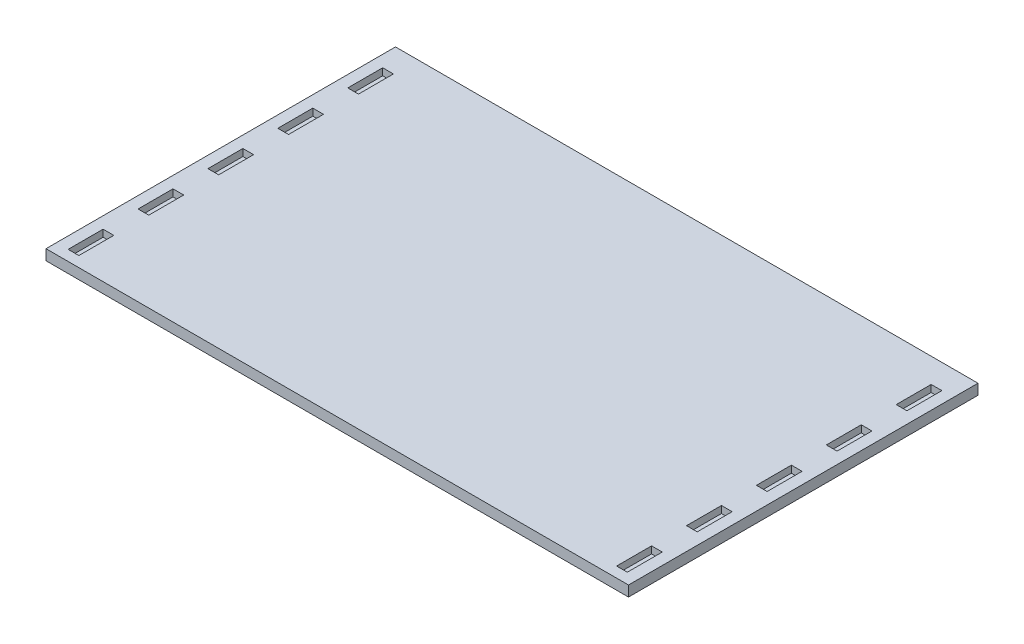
SolidWorks part; units mm, degrees
ref_plane "Front Plane" through (0, 0, 0) normal (0, 0, 1) x (1, 0, 0)
ref_plane "Top Plane" through (0, 0, 0) normal (0, 1, 0) x (1, 0, 0)
ref_plane "Right Plane" through (0, 0, 0) normal (1, 0, 0) x (0, 0, -1)
sketch "Sketch1" plane through (0, 0, 0) normal (0, 1, 0) x (1, 0, 0)
  line L1 (-700.692, 309.2491) -> (299.308, 309.2491)
  line L2 (-700.692, 309.2491) -> (-700.692, -290.7509)
  line L3 (-700.692, -290.7509) -> (299.308, -290.7509)
  line L4 (299.308, 309.2491) -> (299.308, -290.7509)
  dimension "D1" = 600
  dimension "D2" = 1000
extrude "Boss-Extrude1" add sketch "Sketch1" along normal blind 18
sketch "Sketch3" plane through (0, 18, 0) normal (0, 1, 0) x (1, 0, 0)
  line L0 (299.308, 309.2491) -> (-700.692, 309.2491) construction
  line L1 (-662.292, 267.2491) -> (-680.692, 267.2491)
  line L2 (-662.292, 267.2491) -> (-662.292, 207.2491)
  line L3 (-662.292, 207.2491) -> (-680.692, 207.2491)
  line L4 (-680.692, 267.2491) -> (-680.692, 207.2491)
  line L5 (-700.692, 309.2491) -> (-700.692, -290.7509) construction
  dimension "D1" = 18.4
  dimension "D2" = 60
  dimension "D3" = 42
  dimension "D4" = 20
extrude "Cut-Extrude3" cut sketch "Sketch3" against normal blind 12
pattern_linear "LPattern1" count 5 spacing 120 along (0, 0, 1) of "Cut-Extrude3"
sketch "Sketch4" plane through (0, 18, 0) normal (0, 1, 0) x (1, 0, 0)
  line L0 (299.308, -290.7509) -> (299.308, 309.2491) construction
  line L1 (260.908, 267.2491) -> (279.308, 267.2491)
  line L2 (260.908, 267.2491) -> (260.908, 207.2491)
  line L3 (260.908, 207.2491) -> (279.308, 207.2491)
  line L4 (279.308, 267.2491) -> (279.308, 207.2491)
  line L5 (299.308, 309.2491) -> (-700.692, 309.2491) construction
  dimension "D1" = 60
  dimension "D2" = 18.4
  dimension "D3" = 20
  dimension "D4" = 42
extrude "Cut-Extrude4" cut sketch "Sketch4" against normal blind 12
pattern_linear "LPattern2" count 5 spacing 120 along (0, 0, 1) of "Cut-Extrude4"
